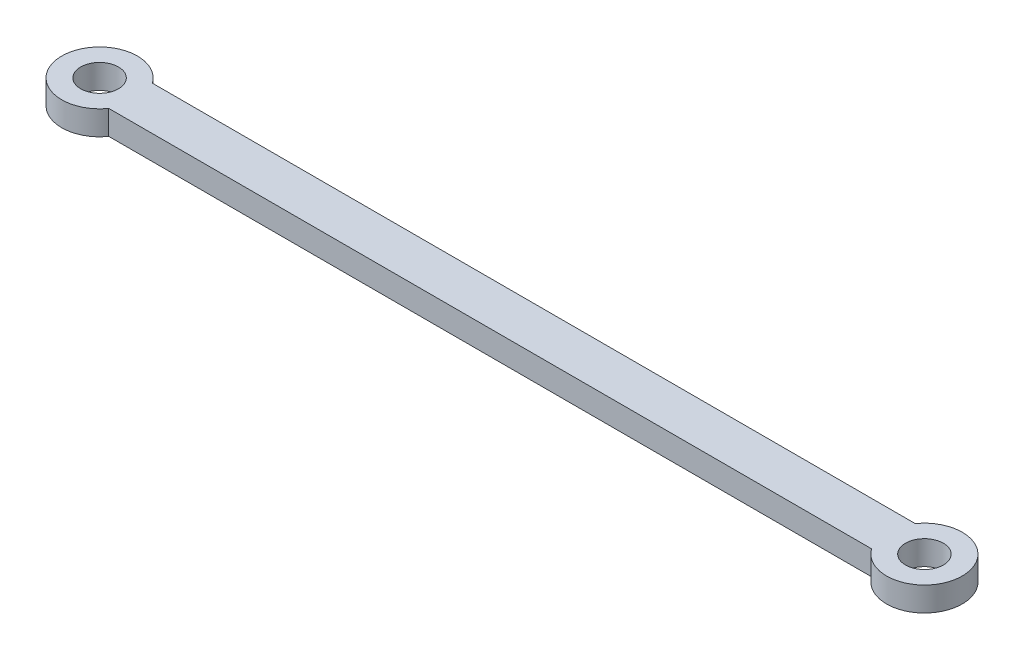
SolidWorks part; units mm, degrees
ref_plane "Front Plane" through (0, 0, 0) normal (0, 0, 1) x (1, 0, 0)
ref_plane "Top Plane" through (0, 0, 0) normal (0, 1, 0) x (1, 0, 0)
ref_plane "Right Plane" through (0, 0, 0) normal (1, 0, 0) x (0, 0, -1)
sketch "Sketch1" plane through (0, 0, 0) normal (0, 1, 0) x (1, 0, 0)
  line L0 (0, 0) -> (78.3381, 0) construction
  line L1 (0, 0) -> (0, 51263.8953) construction
  line L2 (-78.6164, -4.5) -> (78.6164, -4.5)
  line L3 (-78.6164, 4.5) -> (78.6164, 4.5)
  circle A0 centre (85, 0) radius 3.9
  arc A1 (78.6164, -4.5) -> (78.6164, 4.5) centre (85, 0) ccw
  arc A2 (-78.6164, -4.5) -> (-78.6164, 4.5) centre (-85, 0) cw
  circle A3 centre (-85, 0) radius 3.9
  point P10 (0, -4.5)
  point P17 (0, 4.5)
  dimension "D2" = 7.8
  dimension "D1" = 7.8102
  dimension "D3" = 4.5
  dimension "D4" = 85
extrude "Boss-Extrude1" add sketch "Sketch1" along normal blind 5
